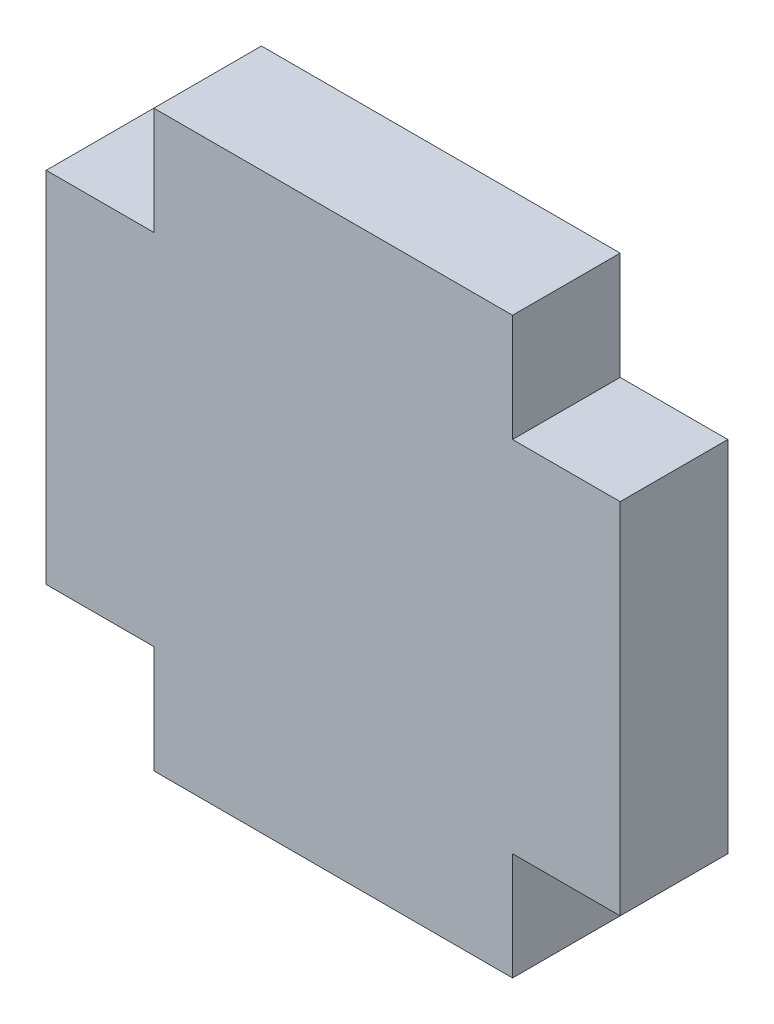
SolidWorks part; units mm, degrees
ref_plane "Alzado" through (0, 0, 0) normal (0, 0, 1) x (1, 0, 0)
ref_plane "Planta" through (0, 0, 0) normal (0, 1, 0) x (1, 0, 0)
ref_plane "Vista lateral" through (0, 0, 0) normal (1, 0, 0) x (0, 0, -1)
sketch "Croquis2" plane through (0, 0, 0) normal (0, 0, 1) x (1, 0, 0)
  line L7 (5, 5) -> (8, 5)
  line L9 (5, -5) -> (8, -5)
  line L10 (8, 5) -> (8, -5)
  line L12 (-5, 5) -> (-5, 8)
  line L13 (-5, 8) -> (5, 8)
  line L14 (5, 5) -> (5, 8)
  line L15 (-5, 5) -> (-8, 5)
  line L17 (-5, -5) -> (-8, -5)
  line L18 (-8, 5) -> (-8, -5)
  line L20 (-5, -5) -> (-5, -8)
  line L21 (-5, -8) -> (5, -8)
  line L22 (5, -5) -> (5, -8)
  point P0 (0, 0)
  point P1 (0, 0)
  point P2 (0, 0)
  point P3 (0, 0)
  point P4 (0, 0)
  point P22 (8, 0)
  point P23 (-8, 0)
  point P24 (0, -8)
  point P25 (0, 8)
extrude "Saliente-Extruir1" add sketch "Croquis2" along normal blind 3
equation "\"kerf\"= 0.20"
equation "\"LargoD\"= 10"
equation "\"D3@Croquis2\"=\"LargoD\""
equation "\"D4@Croquis2\"=\"LargoD\""
equation "\"D5@Croquis2\"=\"LargoD\""
equation "\"D6@Croquis2\"=\"LargoD\""
